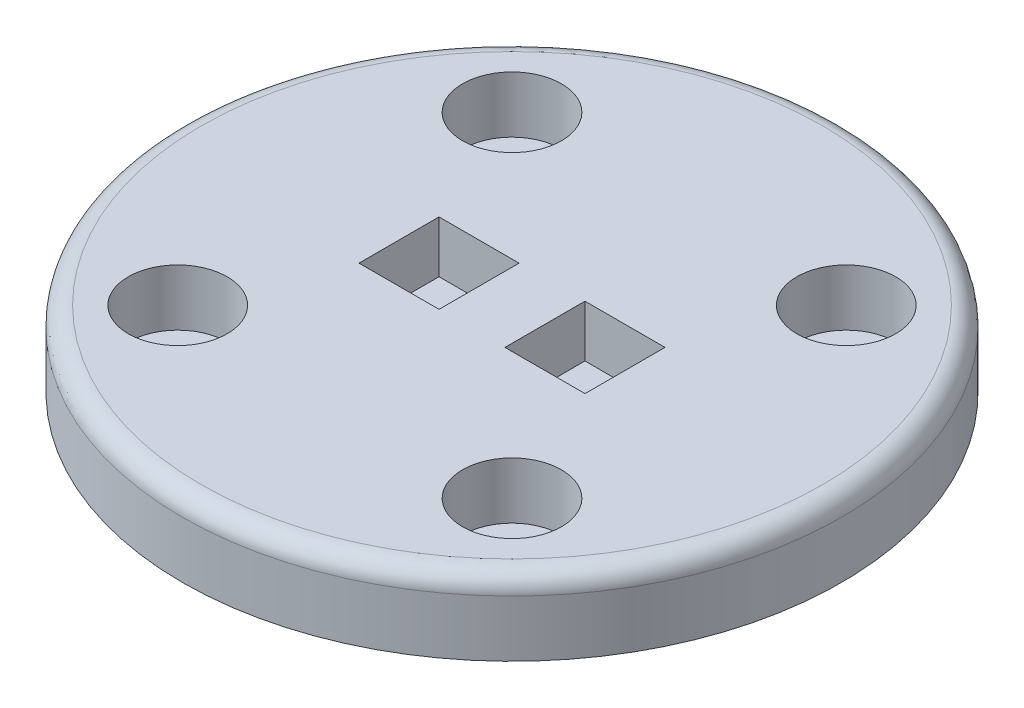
SolidWorks part; units mm, degrees
ref_plane "Front Plane" through (0, 0, 0) normal (0, 0, 1) x (1, 0, 0)
ref_plane "Top Plane" through (0, 0, 0) normal (0, 1, 0) x (1, 0, 0)
ref_plane "Right Plane" through (0, 0, 0) normal (1, 0, 0) x (0, 0, -1)
sketch "Sketch1" plane through (0, 0, 0) normal (0, 1, 0) x (1, 0, 0)
  circle A0 centre (0, 0) radius 35
  dimension "D1" = 70
extrude "Boss-Extrude1" add sketch "Sketch1" along normal blind 8
sketch "Sketch2" plane through (0, 8, 0) normal (0, 1, 0) x (1, 0, 0)
  circle A0 centre (-17.75, 17.75) radius 5.25
  circle A1 centre (17.75, 17.75) radius 5.25
  circle A2 centre (17.75, -17.75) radius 5.25
  circle A3 centre (-17.75, -17.75) radius 5.25
extrude "Cut-Extrude1" cut sketch "Sketch2" against normal blind 6
sketch "Sketch3" plane through (0, 2, 0) normal (0, 1, 0) x (1, 0, 0)
  circle A0 centre (17.75, 17.75) radius 3.25
  circle A1 centre (-17.75, 17.75) radius 3.25
  circle A2 centre (-17.75, -17.75) radius 3.25
  circle A3 centre (17.75, -17.75) radius 3.25
  dimension "D1" = 6.5
extrude "Cut-Extrude2" cut sketch "Sketch3" against normal blind 2
sketch "Sketch4" plane through (0, 8, 0) normal (0, 1, 0) x (1, 0, 0)
  line L1 (-12, 4.25) -> (-3.5, 4.25)
  line L2 (-12, 4.25) -> (-12, -4.25)
  line L3 (-12, -4.25) -> (-3.5, -4.25)
  line L4 (-3.5, 4.25) -> (-3.5, -4.25)
  line L5 (3.5, 4.25) -> (3.5, -4.25)
  line L6 (12, -4.25) -> (3.5, -4.25)
  line L7 (12, 4.25) -> (12, -4.25)
  line L8 (12, 4.25) -> (3.5, 4.25)
extrude "Cut-Extrude3" cut sketch "Sketch4" against normal blind 5.5
fillet "Fillet1" radius 2 1 edges at (0, 8, 35)
equation "\"D5@Sketch2\"=\"D4@Sketch2\"/2"
equation "\"D9@Sketch2\"=\"D8@Sketch2\"/2"
equation "\"D3@Sketch2\"=\"D2@Sketch2\"/2"
equation "\"D7@Sketch2\"=\"D6@Sketch2\"/2"
equation "\"D3@Sketch4\"=\"D2@Sketch4\"/2"
